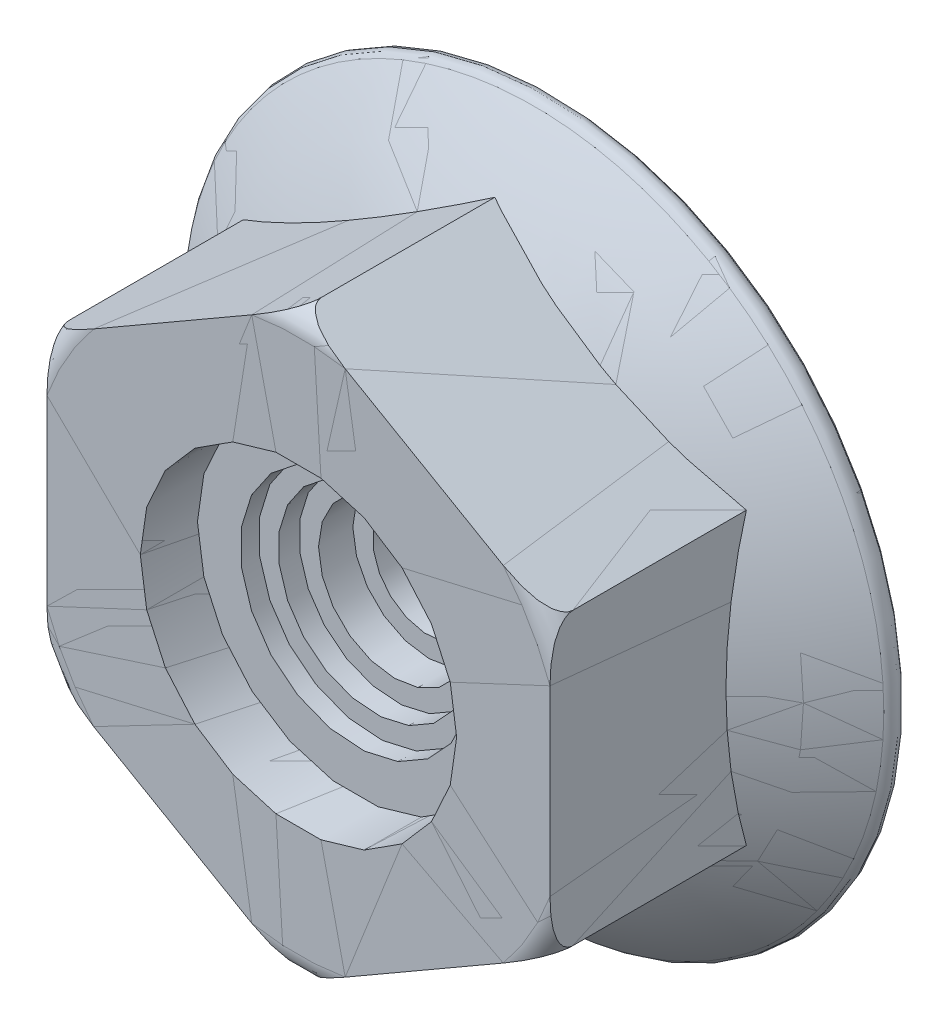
SolidWorks part; units mm, degrees
ref_plane "Plane1" through (0, 0, 0) normal (0, 0, 1) x (1, 0, 0)
ref_plane "Plane2" through (0, 0, 0) normal (0, 1, 0) x (-1, 0, 0)
ref_plane "Plane3" through (0, 0, 0) normal (1, 0, 0) x (0, 0, -1)
sketch "Head Sketch" plane through (0, 0, 0) normal (0, 0, 1) x (1, 0, 0)
  line L0 (0, 12.7017) -> (11, 6.3509)
  line L1 (11, 6.3509) -> (11, -6.3509)
  line L2 (11, -6.3509) -> (0, -12.7017)
  line L3 (0, -12.7017) -> (-11, -6.3509)
  line L4 (-11, -6.3509) -> (-11, 6.3509)
  line L5 (-11, 6.3509) -> (0, 12.7017)
  line L6 (11, 6.3509) -> (-11, -6.3509) construction
  line L7 (0, 12.7017) -> (0, -12.7017) construction
  line L8 (-11, 6.3509) -> (11, -6.3509) construction
  point P0 (0, 0)
  dimension "D1" = 60
  dimension "D2" = 60
  dimension "Flats" = 22
extrude "Head" add sketch "Head Sketch" along normal blind 11.2
sketch "Flange Sketch" plane through (0, 0, 0) normal (0, 1, 0) x (-1, 0, 0)
  line L0 (0, 1.8434) -> (0, 6) construction
  line L1 (-15, 0) -> (0, 0)
  line L2 (0, 50) -> (0, -50) construction
  line L4 (0, 0) -> (0, 6)
  line L5 (0, 0) -> (-11, 0) construction
  arc A0 (0, 6) -> (-15.3, 0.9) centre (0, -19.5) ccw
  arc A1 (-15, 0) -> (-15.3, 0.9) centre (-15, 0.5) cw
  dimension "D1" = 0.5
  dimension "D3" = 30
  dimension "Flange Height" = 6
revolve "Flange" add sketch "Flange Sketch" angle 360 about L0
sketch "Sketch5" plane through (0, 0, 0) normal (1, 0, 0) x (0, 0, -1)
  line L0 (-11.2, -11.7017) -> (-11.2, -12.7017)
  line L1 (-11.2, -12.7017) -> (-10.2, -12.7017)
  line L2 (-11.2, -12.7017) -> (-2.6115, -12.7017) construction
  line L3 (-11.2, -12.7017) -> (-11.2, -6.3509) construction
  line L5 (-15.0856, 0) -> (-8.1394, 0) construction
  line L6 (50, 0) -> (-50, 0) construction
  arc A0 (-11.2, -11.7017) -> (-10.2, -12.7017) centre (-10.2, -11.7017) ccw
  dimension "D1" = 1
revolve "Head Trim" cut sketch "Sketch5" angle 360 about L5
sketch "Hole Sketch" plane through (0, 0, 11.2) normal (0, 0, 1) x (1, 0, 0)
  line L0 (50, 0) -> (-50, 0) construction
  line L1 (0, -50) -> (0, 50) construction
  circle A0 centre (0, 0) radius 6.9175
  dimension "Hole Dia" = 13.835
extrude "Through Hole" cut sketch "Hole Sketch" against normal through all
